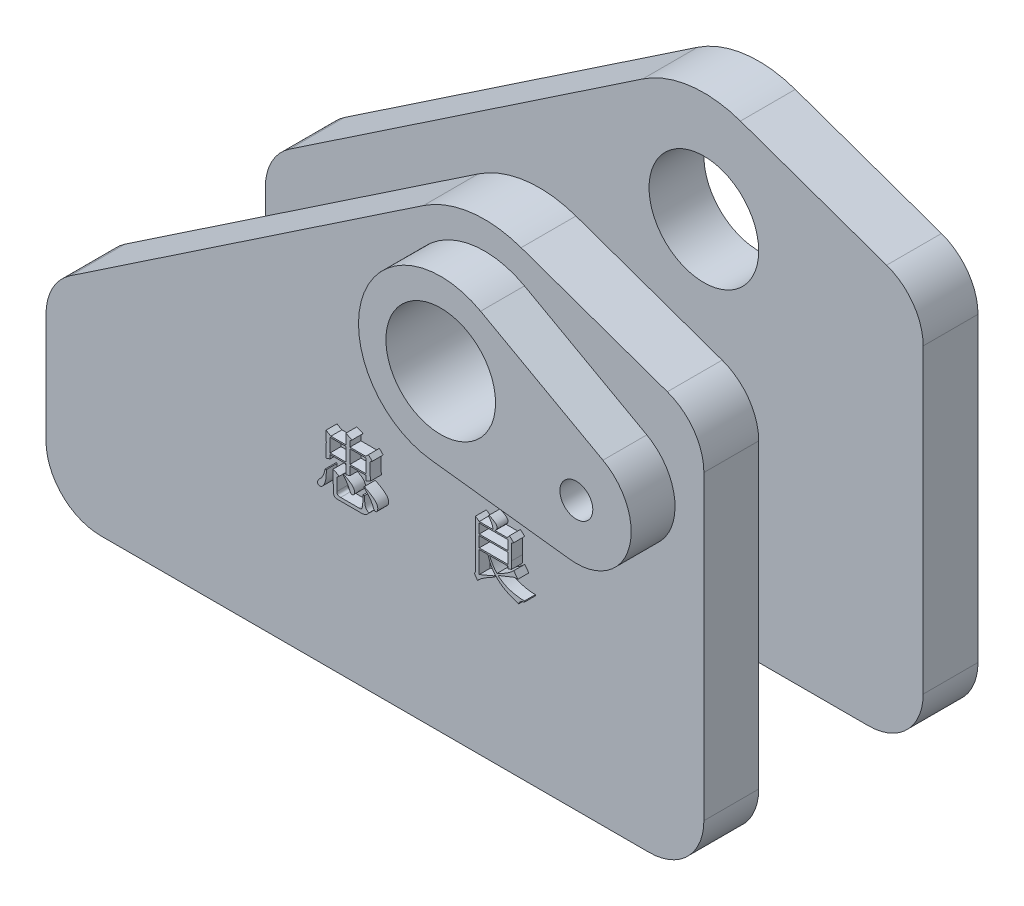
SolidWorks part; units mm, degrees
ref_plane "前视基准面" through (0, 0, 0) normal (0, 0, 1) x (1, 0, 0)
ref_plane "上视基准面" through (0, 0, 0) normal (0, 1, 0) x (1, 0, 0)
ref_plane "右视基准面" through (0, 0, 0) normal (1, 0, 0) x (0, 0, -1)
sketch "草图1" plane through (0, 0, 0) normal (0, 0, 1) x (1, 0, 0)
  line L0 (-120, 0) -> (0, 0)
  line L1 (0, 0) -> (0, 65)
  line L2 (-6.6667, 74.4281) -> (-33.3333, 83.8562)
  line L3 (-51.1567, 81.5991) -> (-115.5783, 38.2995)
  line L4 (-120, 30) -> (-120, 0)
  arc A0 (-115.5783, 38.2995) -> (-120, 30) centre (-110, 30) ccw
  arc A1 (0, 65) -> (-6.6667, 74.4281) centre (-10, 65) ccw
  arc A2 (-33.3333, 83.8562) -> (-51.1567, 81.5991) centre (-40, 65) ccw
  circle A3 centre (-40, 65) radius 14.9286 construction
  dimension "D2" = 10
  dimension "D3" = 20
  dimension "D4" = 30
  dimension "D5" = 85
  dimension "D7" = 40
  dimension "D1" = 120
extrude "拉伸1" add sketch "草图1" along normal blind 10 from offset 15
sketch "草图2" plane through (0, 0, 0) normal (0, 0, 1) x (1, 0, 0)
  line L5 (-120, 30) -> (-120, 0)
  line L6 (-51.1567, 81.5991) -> (-115.5783, 38.2995)
  line L7 (-6.6667, 74.4281) -> (-33.3333, 83.8562)
  line L8 (0, 0) -> (0, 65)
  line L9 (-120, 0) -> (0, 0)
  line L10 (-120, 30) -> (-120, 0)
  line L11 (-51.1567, 81.5991) -> (-115.5783, 38.2995)
  line L12 (-6.6667, 74.4281) -> (-33.3333, 83.8562)
  line L13 (0, 0) -> (0, 65)
  line L14 (-120, 0) -> (0, 0)
  arc A3 (-115.5783, 38.2995) -> (-120, 30) centre (-110, 30) ccw
  arc A4 (-33.3333, 83.8562) -> (-51.1567, 81.5991) centre (-40, 65) ccw
  arc A5 (0, 65) -> (-6.6667, 74.4281) centre (-10, 65) ccw
  arc A6 (-115.5783, 38.2995) -> (-120, 30) centre (-110, 30) ccw
  arc A7 (-33.3333, 83.8562) -> (-51.1567, 81.5991) centre (-40, 65) ccw
  arc A8 (0, 65) -> (-6.6667, 74.4281) centre (-10, 65) ccw
  dimension "D1" = 0
extrude "拉伸2" add sketch "草图2" against normal blind 10 from offset 15
fillet "圆角1" radius 10 2 edges at (-120, 0, 20) (0, 0, 20)
fillet "圆角2" radius 10 2 edges at (0, 0, -20) (-120, 0, -20)
sketch "草图3" plane through (0, 0, 25) normal (0, 0, 1) x (1, 0, 0)
  line L0 (-40, 65) -> (-15.2614, 57) construction
  line L1 (-110, 0) -> (-10, 0) construction
  line L2 (-41.7846, 50.1065) -> (-16.4511, 47.071)
  line L3 (-32.7261, 78.1183) -> (-10.4121, 65.7455)
  arc A0 (-32.7261, 78.1183) -> (-41.7846, 50.1065) centre (-40, 65) ccw
  arc A1 (-16.4511, 47.071) -> (-10.4121, 65.7455) centre (-15.2614, 57) ccw
  dimension "D1" = 30
  dimension "D2" = 20
  dimension "D4" = 57
  dimension "D3" = 26
extrude "拉伸3" add sketch "草图3" along normal blind 8
sketch "草图4" plane through (0, 0, 33) normal (0, 0, 1) x (1, 0, 0)
  circle A0 centre (-40, 65) radius 10
  dimension "D1" = 20
extrude "切除-拉伸1" cut sketch "草图4" against normal through all
sketch "草图5" plane through (0, 0, 33) normal (0, 0, 1) x (1, 0, 0)
  circle A0 centre (-15.2614, 57) radius 3
  dimension "D1" = 6
extrude "切除-拉伸2" cut sketch "草图5" against normal blind 30
sketch "草图6" plane through (0, 0, 25) normal (0, 0, 1) x (1, 0, 0)
  line L0 (0, 10) -> (0, 65) construction
  line L1 (-70, 30) -> (-30, 30)
  line L2 (-70, 30) -> (-70, 22)
  line L3 (-70, 22) -> (-30, 22)
  line L4 (-30, 30) -> (-30, 22)
  circle A0 centre (-40, 65) radius 10 construction
  dimension "D4" = 35
  dimension "D1" = 8
  dimension "D2" = 40
  dimension "D3" = 30
extrude "拉伸4" add sketch "草图6" against normal up to surface (40 mm away)
sketch "草图7" plane through (0, 0, 25) normal (0, 0, 1) x (1, 0, 0)
  text T0 "忠    良" font "Century Gothic" height in points 26
extrude "拉伸5" add sketch "草图7" along normal blind 2
